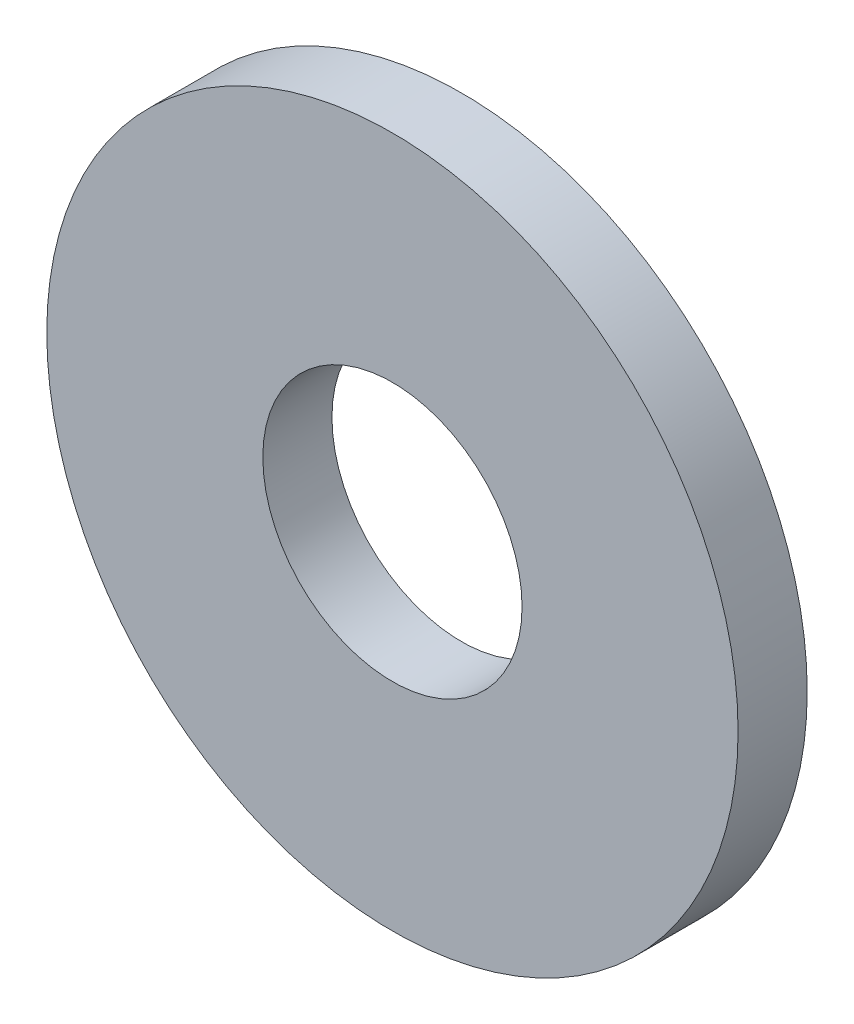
SolidWorks part; units mm, degrees
ref_plane "Plan de face" through (0, 0, 0) normal (0, 0, 1) x (1, 0, 0)
ref_plane "Plan de dessus" through (0, 0, 0) normal (0, 1, 0) x (1, 0, 0)
ref_plane "Plan de droite" through (0, 0, 0) normal (1, 0, 0) x (0, 0, -1)
sketch "Esquisse1" plane through (0, 0, 0) normal (0, 0, 1) x (1, 0, 0)
  circle A0 centre (0, 0) radius 4
  circle A1 centre (0, 0) radius 1.5
extrude "Extrusion1" add sketch "Esquisse1" along normal blind 0.8
